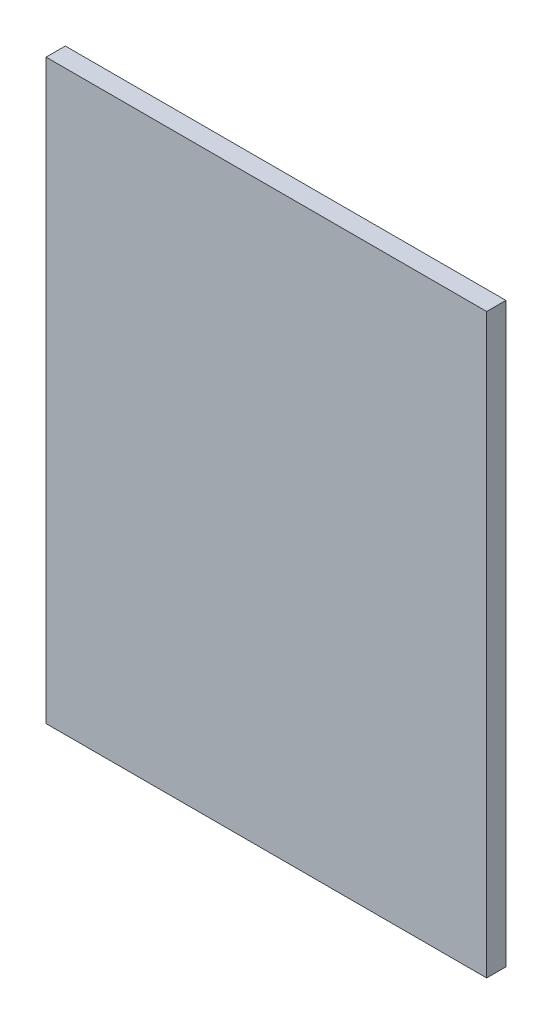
SolidWorks part; units mm, degrees
ref_plane "Front Plane" through (0, 0, 0) normal (0, 0, 1) x (1, 0, 0)
ref_plane "Top Plane" through (0, 0, 0) normal (0, 1, 0) x (1, 0, 0)
ref_plane "Right Plane" through (0, 0, 0) normal (1, 0, 0) x (0, 0, -1)
sketch "Sketch1" plane through (0, 0, 0) normal (0, 0, 1) x (1, 0, 0)
  line L1 (0, 0) -> (114.5, 0)
  line L2 (0, 0) -> (0, 150)
  line L3 (0, 150) -> (114.5, 150)
  line L4 (114.5, 0) -> (114.5, 150)
  dimension "D1" = 114.5
  dimension "D2" = 150
extrude "Boss-Extrude1" add sketch "Sketch1" along normal blind 5
